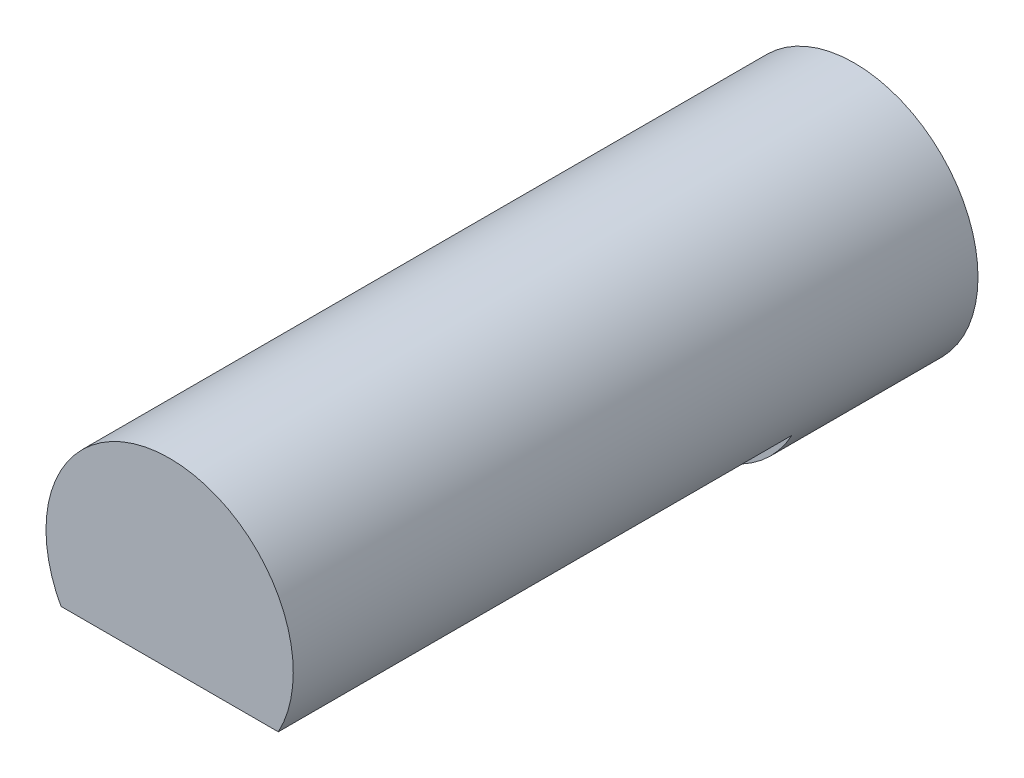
SolidWorks part; units mm, degrees
ref_plane "Plan de face" through (0, 0, 0) normal (0, 0, 1) x (1, 0, 0)
ref_plane "Plan de dessus" through (0, 0, 0) normal (0, 1, 0) x (1, 0, 0)
ref_plane "Plan de droite" through (0, 0, 0) normal (1, 0, 0) x (0, 0, -1)
sketch "Esquisse1" plane through (0, 0, 0) normal (0, 0, 1) x (1, 0, 0)
  circle A0 centre (0, 0) radius 3.25
  dimension "D1" = 6.5
extrude "Extrusion1" add sketch "Esquisse1" along normal blind 18
sketch "Esquisse2" plane through (0, 0, 18) normal (0, 0, 1) x (1, 0, 0)
  line L0 (-2.8566, -1.55) -> (2.8566, -1.55)
  line L1 (0, 3.25) -> (0, -3.25) construction
  line L2 (-3.25, 0) -> (-3.25, -3.4222) construction
  line L3 (3.25, 0) -> (3.25, -3.25) construction
  circle A0 centre (0, 0) radius 3.25
  dimension "D1" = 6.5
  dimension "D2" = 4.8
extrude "Enlèv. mat.-Extru.1" cut sketch "Esquisse2" against normal blind 13.5
